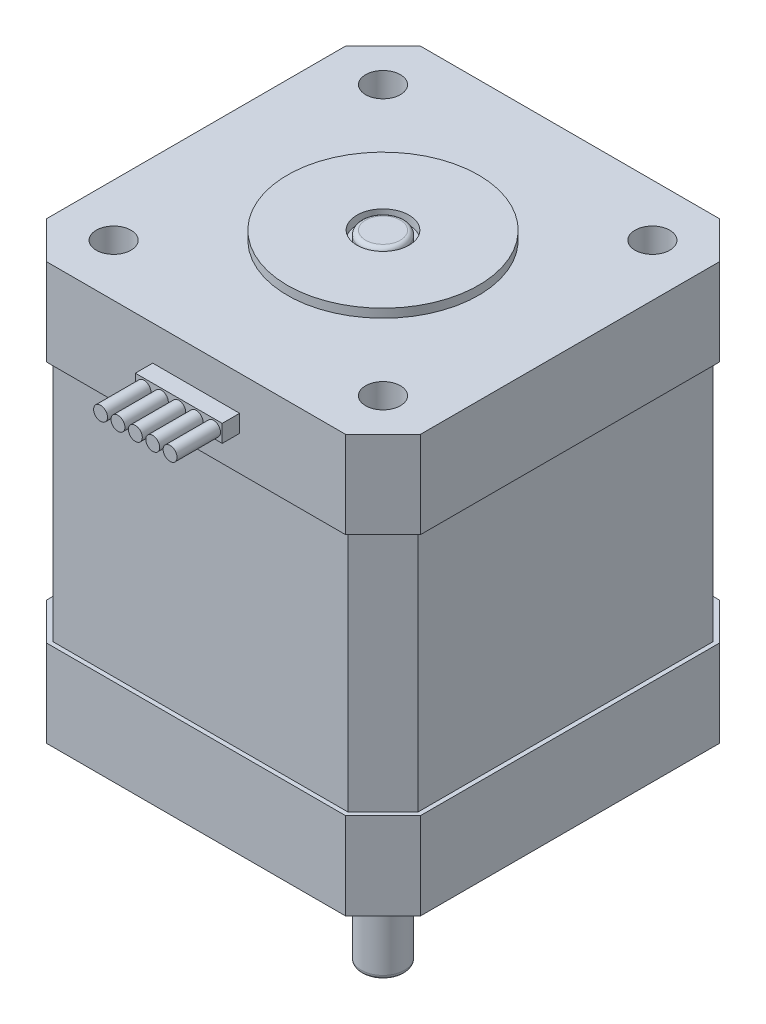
SolidWorks part; units mm, degrees
ref_plane "Front Plane" through (0, 0, 0) normal (0, 0, 1) x (1, 0, 0)
ref_plane "Top Plane" through (0, 0, 0) normal (0, 1, 0) x (1, 0, 0)
ref_plane "Right Plane" through (0, 0, 0) normal (1, 0, 0) x (0, 0, -1)
sketch "Sketch2" plane through (0, 0, 0) normal (0, 1, 0) x (1, 0, 0)
  line L1 (-21, -21) -> (21, -21)
  line L2 (-21, -21) -> (-21, 21)
  line L3 (-21, 21) -> (21, 21)
  line L4 (21, -21) -> (21, 21)
  line L5 (-21, -21) -> (21, 21) construction
  line L6 (-21, 21) -> (21, -21) construction
  point P0 (0, 0)
extrude "Boss-Extrude1" add sketch "Sketch2" against normal blind 48
sketch "Sketch14" plane through (0, -48, 0) normal (0, -1, 0) x (1, 0, 0)
  line L0 (-21, 0) -> (0, 0) construction
  line L5 (-21, -21) -> (-21, 21) construction
  line L6 (0, 21) -> (0, -21) construction
  line L7 (-21, 21) -> (21, 21) construction
  line L8 (21, -21) -> (-21, -21) construction
  circle A0 centre (-15.5, 15.5) radius 2
  circle A1 centre (-15.5, -15.5) radius 2
  circle A2 centre (15.5, -15.5) radius 2
  circle A3 centre (15.5, 15.5) radius 2
extrude "Cut-Extrude3" cut sketch "Sketch14" against normal blind 4.5
sketch "Sketch13" plane through (0, 0, 0) normal (0, 1, 0) x (1, 0, 0)
  line L0 (0, 21) -> (0, -21) construction
  line L1 (21, 21) -> (-21, 21) construction
  line L2 (-21, -21) -> (21, -21) construction
  line L3 (0, -21) -> (0, 0) construction
  line L4 (0, 0) -> (21, 0) construction
  line L5 (21, -21) -> (21, 21) construction
  circle A0 centre (-15.5, 15.5) radius 2
  circle A1 centre (15.5, 15.5) radius 2
  circle A2 centre (15.5, -15.5) radius 2
  circle A3 centre (-15.5, -15.5) radius 2
extrude "Cut-Extrude2" cut sketch "Sketch13" against normal blind 4.5
sketch "Sketch3" plane through (0, 0, 0) normal (0, 1, 0) x (1, 0, 0)
  line L0 (0, 21) -> (0, -21) construction
  line L1 (21, 21) -> (-21, 21) construction
  line L2 (-21, -21) -> (21, -21) construction
  line L3 (0, 0) -> (-21, 0) construction
  line L4 (-21, 21) -> (-21, -21) construction
  line L5 (-21, 21) -> (-17, 21)
  line L6 (-21, 21) -> (-21, 17)
  line L7 (-17, 21) -> (-21, 17)
  line L8 (-21, -21) -> (-21, -17)
  line L9 (-21, -21) -> (-17, -21)
  line L10 (-17, -21) -> (-21, -17)
  line L11 (21, -21) -> (17, -21)
  line L12 (21, -21) -> (21, -17)
  line L13 (17, -21) -> (21, -17)
  line L14 (21, 21) -> (21, 17)
  line L15 (21, 21) -> (17, 21)
  line L16 (17, 21) -> (21, 17)
extrude "Cut-Extrude1" cut sketch "Sketch3" against normal blind 48
sketch "Sketch4" plane through (0, -48, 0) normal (0, -1, 0) x (1, 0, 0)
  line L0 (-17, 21) -> (17, 21)
  line L1 (17, 21) -> (21, 17)
  line L2 (21, 17) -> (21, -17)
  line L3 (21, -17) -> (17, -21)
  line L4 (17, -21) -> (-17, -21)
  line L5 (17, -21) -> (-17, -21) construction
  line L6 (-17, -21) -> (-21, -17)
  line L7 (-21, -17) -> (-17, -21) construction
  line L8 (-21, -17) -> (-21, 17)
  line L9 (-21, -17) -> (-21, 17) construction
  line L10 (-21, 17) -> (-17, 21)
  line L11 (-21.5, 17.2071) -> (-17.2071, 21.5)
  line L12 (-17.2071, 21.5) -> (17.2071, 21.5)
  line L13 (17.2071, 21.5) -> (21.5, 17.2071)
  line L14 (21.5, 17.2071) -> (21.5, -17.2071)
  line L15 (21.5, -17.2071) -> (17.2071, -21.5)
  line L16 (17.2071, -21.5) -> (-17.2071, -21.5)
  line L17 (-17.2071, -21.5) -> (-21.5, -17.2071)
  line L18 (-21.5, -17.2071) -> (-21.5, 17.2071)
  dimension "D1" = 0.5
extrude "Boss-Extrude2" add sketch "Sketch4" against normal blind 10
sketch "Sketch5" plane through (0, 0, 0) normal (0, 1, 0) x (1, 0, 0)
  line L0 (-17, 21) -> (17, 21)
  line L1 (17, 21) -> (21, 17)
  line L2 (21, 17) -> (21, -17)
  line L3 (21, -17) -> (17, -21)
  line L4 (17, -21) -> (-17, -21)
  line L5 (-17, -21) -> (-21, -17)
  line L6 (-21, -17) -> (-21, 17)
  line L7 (-21, 17) -> (-17, 21)
  line L8 (-21.5, 17.2071) -> (-17.2071, 21.5)
  line L9 (-17.2071, 21.5) -> (17.2071, 21.5)
  line L10 (17.2071, 21.5) -> (21.5, 17.2071)
  line L11 (21.5, 17.2071) -> (21.5, -17.2071)
  line L12 (21.5, -17.2071) -> (17.2071, -21.5)
  line L13 (17.2071, -21.5) -> (-17.2071, -21.5)
  line L14 (-17.2071, -21.5) -> (-21.5, -17.2071)
  line L15 (-21.5, -17.2071) -> (-21.5, 17.2071)
  dimension "D1" = 0.5
extrude "Boss-Extrude3" add sketch "Sketch5" against normal blind 10
sketch "Sketch6" plane through (0, 0, 0) normal (0, 1, 0) x (1, 0, 0)
  circle A0 centre (0, 0) radius 11
  circle A1 centre (0, 0) radius 3
  circle A2 centre (0, 0) radius 2.5
extrude "Boss-Extrude4" add sketch "Sketch6" along normal blind 1 contours A0 A1 | A2
sketch "Sketch7" plane through (0, -48, 0) normal (0, -1, 0) x (1, 0, 0)
  circle A0 centre (0, 0) radius 11
extrude "Boss-Extrude5" add sketch "Sketch7" along normal blind 2
sketch "Sketch8" plane through (0, -50, 0) normal (0, -1, 0) x (1, 0, 0)
  circle A0 centre (0, 0) radius 2.5
extrude "Boss-Extrude6" add sketch "Sketch8" along normal blind 22
fillet "Fillet1" radius 0.5 1 edges at (0, -72, -2.5)
fillet "Fillet2" radius 0.5 1 edges at (0, 1, 2.5)
sketch "Sketch9" plane through (0, 0, 21.5) normal (0, 0, 1) x (1, 0, 0)
  line L0 (0, 0) -> (0, -5) construction
  line L2 (-5, -6) -> (5, -6)
  line L3 (-5, -6) -> (-5, -4)
  line L4 (-5, -4) -> (5, -4)
  line L5 (5, -6) -> (5, -4)
  line L6 (-5, -6) -> (5, -4) construction
  line L7 (-5, -4) -> (5, -6) construction
extrude "Boss-Extrude7" add sketch "Sketch9" along normal blind 2
sketch "Sketch11" plane through (0, 0, 23.5) normal (0, 0, 1) x (1, 0, 0)
  circle A0 centre (-4, -5) radius 0.8
  circle A1 centre (-2, -5) radius 0.8
  circle A2 centre (0, -5) radius 0.8
  circle A3 centre (2, -5) radius 0.8
  circle A4 centre (4, -5) radius 0.8
  dimension "D1" = 5
extrude "Boss-Extrude10" add sketch "Sketch11" along normal blind 5
